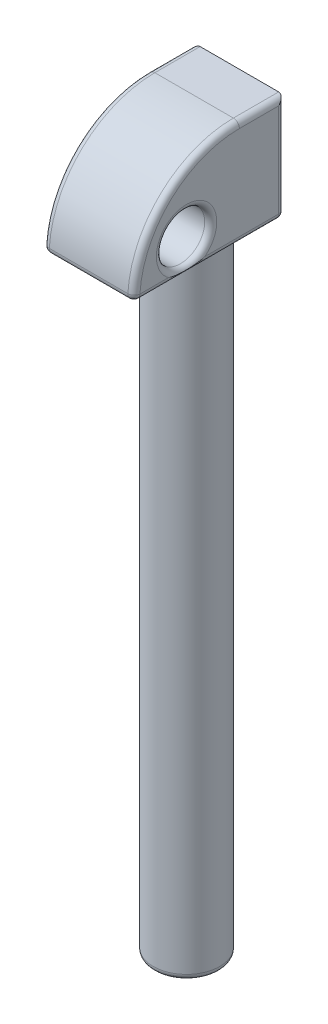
SolidWorks part; units mm, degrees
ref_plane "Plan1" through (0, 0, 0) normal (0, 0, 1) x (1, 0, 0)
ref_plane "Plan2" through (0, 0, 0) normal (0, 1, 0) x (1, 0, 0)
ref_plane "Plan3" through (0, 0, 0) normal (1, 0, 0) x (0, 0, -1)
sketch "Esquisse1" plane through (0, 0, 0) normal (0, 0, 1) x (1, 0, 0)
  line L0 (0, 10.5831) -> (0, -39.95) construction
  line L1 (0, 21) -> (2.2, 21)
  line L4 (0, 21) -> (0, -21)
  line L5 (0, -21) -> (2.2, -21)
  line L6 (2.2, -21) -> (2.2, 21)
  dimension "D1" = 4.4
  dimension "D2" = 42
revolve "Base-Révolution" add sketch "Esquisse1" angle 360 about L0
sketch "Esquisse2" plane through (0, 0, 0) normal (1, 0, 0) x (0, 0, -1)
  line L0 (-6.5, 21) -> (3.5, 21)
  line L1 (3.5, 21) -> (3.5, 28)
  line L2 (3.5, 28) -> (0.5, 28)
  line L3 (2.2, 21) -> (-2.2, 21) construction
  arc A0 (-6.5, 21) -> (0.5, 28) centre (0.5, 21) cw
  circle A1 centre (-3, 23) radius 1.6
  dimension "D4" = 3.2
  dimension "D6" = 2
  dimension "D1" = 3.5
  dimension "D2" = 7
  dimension "D3" = 10
  dimension "D5" = 3
extrude "Boss.-Extru.1" add sketch "Esquisse2" along normal mid plane 6
fillet "Congé2" radius 0.4
